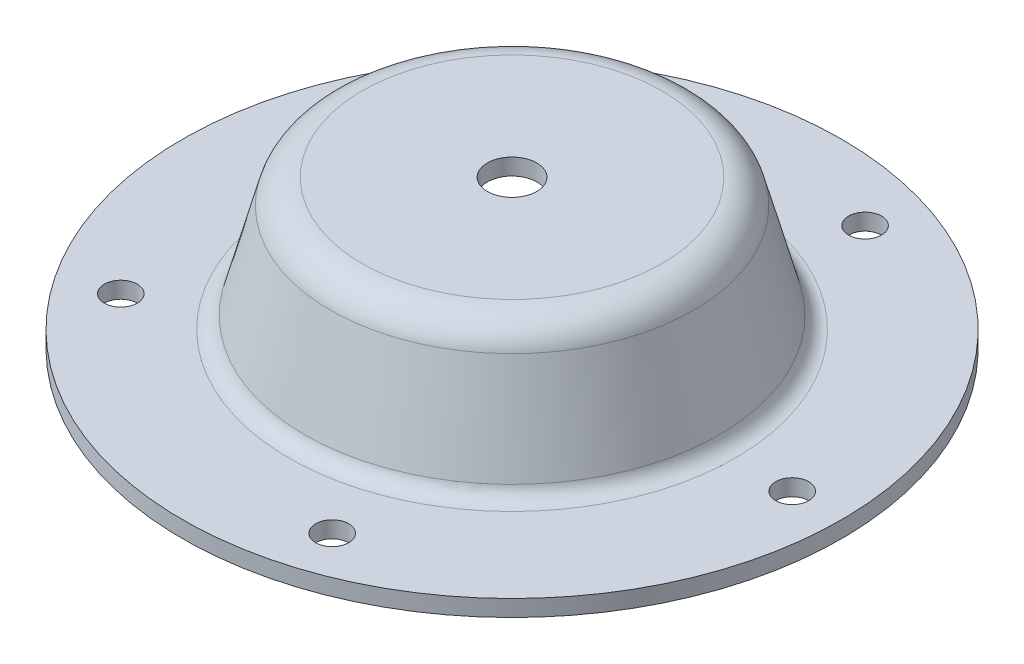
SolidWorks part; units mm, degrees
ref_plane "Front Plane" through (0, 0, 0) normal (0, 0, 1) x (1, 0, 0)
ref_plane "Top Plane" through (0, 0, 0) normal (0, 1, 0) x (1, 0, 0)
ref_plane "Right Plane" through (0, 0, 0) normal (1, 0, 0) x (0, 0, -1)
sketch "Sketch1" plane through (0, 0, 0) normal (0, 0, 1) x (1, 0, 0)
  line L0 (-63.5, 0) -> (-42.9725, 0)
  line L1 (-36.8389, 4.7065) -> (-31.9246, 23.0468)
  line L2 (-28.8578, 25.4) -> (0, 25.4)
  line L3 (0, 0) -> (0, 57.8445) construction
  arc A0 (-42.9725, 0) -> (-36.8389, 4.7065) centre (-42.9725, 6.35) ccw
  arc A1 (-31.9246, 23.0468) -> (-28.8578, 25.4) centre (-28.8578, 22.225) cw
  point P9 (-38.1, 0)
  dimension "D5" = 6.35
  dimension "D6" = 3.175
  dimension "D1" = 127
  dimension "D2" = 25.4
  dimension "D3" = 25.4
  dimension "D4" = 75
revolve "Revolve-Thin1" add sketch "Sketch1" angle 360 about L3
hole_wizard "3/8-16 Tapped Hole1" positions "Sketch3" profile "Sketch2" tap size "3/8-16" standard "Ansi Inch"
sketch "Sketch3" plane through (0, 28.575, 0) normal (0, 1, 0) x (-1, 0, 0)
  circle A0 centre (0, 0) radius 28.8578 construction
  point P0 (0, 0)
sketch "Sketch2" plane through (0, 28.575, 0) normal (1, 0, 0) x (0, 0, 1)
  line L0 (0, 0) -> (0, 28.575)
  line L1 (0, 28.575) -> (4.7625, 28.575)
  line L2 (4.7625, 28.575) -> (4.7625, 0)
  line L5 (4.7625, 0) -> (0, 0)
  line L11 (0, -6.35) -> (0, 107.95) construction
  dimension "Thread Major Dia." = 9.525
  dimension "Thru Tap Drill Depth" = 28.575
hole_wizard "1/4 (0.25) Diameter Hole1" positions "Sketch5" profile "Sketch4" hole size "1/4" standard "Ansi Inch"
sketch "Sketch5" plane through (0, 3.175, 0) normal (0, 1, 0) x (-1, 0, 0)
  circle A0 centre (0, 0) radius 53.975 construction
  point P0 (-53.975, 0)
  dimension "D1" = 107.95
sketch "Sketch4" plane through (53.975, 3.175, 0) normal (1, 0, 0) x (0, 0, 1)
  line L0 (0, 0) -> (0, 3.175)
  line L1 (0, 3.175) -> (3.175, 3.175)
  line L2 (3.175, 3.175) -> (3.175, 0)
  line L5 (3.175, 0) -> (0, 0)
  line L11 (0, -6.35) -> (0, 107.95) construction
  dimension "Thru Hole Dia." = 6.35
  dimension "Thru Hole Depth" = 3.175
pattern_circular "CirPattern1" count 5 over 360 about axis through (0, 0, 0) along (0, 1, 0) of "1/4 (0.25) Diameter Hole1"
